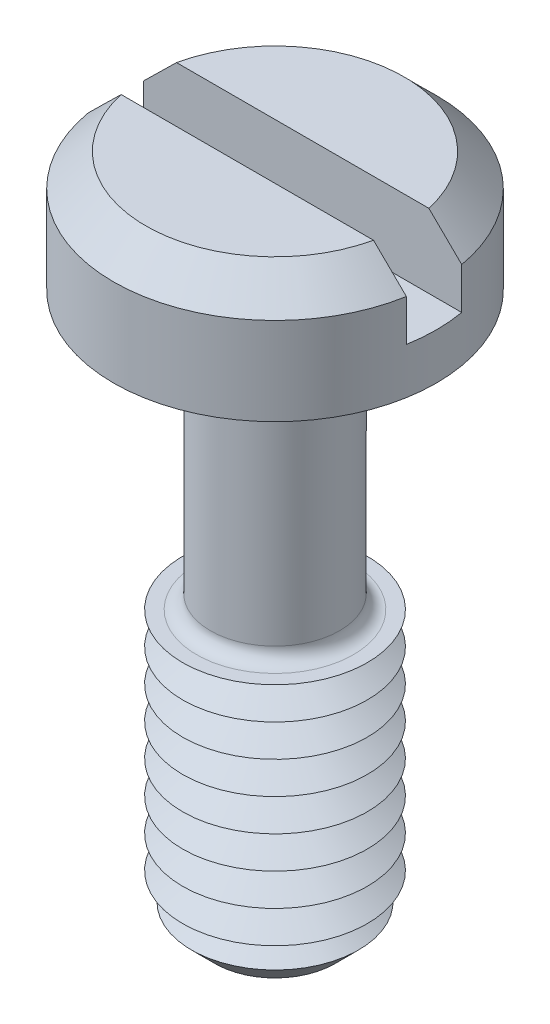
SolidWorks part; units mm, degrees
ref_plane "Front Plane" through (0, 0, 0) normal (0, 0, 1) x (1, 0, 0)
ref_plane "Top Plane" through (0, 0, 0) normal (0, 1, 0) x (1, 0, 0)
ref_plane "Right Plane" through (0, 0, 0) normal (1, 0, 0) x (0, 0, -1)
sketch "Sketch1" plane through (0, 0, 0) normal (0, 1, 0) x (1, 0, 0)
  circle A0 centre (0, 0) radius 3.5
  dimension "D1" = 7
extrude "Boss-Extrude1" add sketch "Sketch1" along normal blind 2.6
sketch "Sketch2" plane through (0, 0, 0) normal (0, -1, 0) x (1, 0, 0)
  circle A0 centre (0, 0) radius 1.4
  dimension "D1" = 2.8
extrude "Boss-Extrude2" add sketch "Sketch2" along normal blind 12
sketch "Sketch3" plane through (0, -12, 0) normal (0, -1, 0) x (1, 0, 0)
  circle A0 centre (0, 0) radius 2
  dimension "D1" = 4
extrude "Boss-Extrude3" add sketch "Sketch3" against normal blind 6
chamfer "Chamfer1" distance 0.7 angle 45 1 edges at (0, -12, -2)
sketch "Sketch4" plane through (0, 0, 0) normal (1, 0, 0) x (0, 0, -1)
  line L0 (0, -6.5871) -> (0, -12.0372) construction
sketch "Sketch5" plane through (0, 0, 0) normal (1, 0, 0) x (0, 0, -1)
  line L0 (-2, -6) -> (-1.3938, -6.35)
  line L1 (-1.3938, -6.35) -> (-2, -6.7)
  line L2 (-2, -6) -> (-2, -11.3) construction
  line L3 (-2, -6.7) -> (-2, -6)
  dimension "D1" = 0.7
revolve "Cut-Revolve1" cut sketch "Sketch5" angle 360 about L0
pattern_linear "LPattern1" count 8 spacing 0.7 along (0, -1, 0) of "Cut-Revolve1"
fillet "Fillet1" radius 0.3 2 edges at (0, -6, -1.4) (0, 0, -1.4)
chamfer "Chamfer2" distance 0.7 angle 45 1 edges at (0, 2.6, 3.5)
sketch "Sketch6" plane through (0, 2.6, 0) normal (0, 1, 0) x (1, 0, 0)
  line L1 (3.5, -0.6) -> (-3.5, -0.6)
  line L2 (3.5, -0.6) -> (3.5, 0.6)
  line L3 (3.5, 0.6) -> (-3.5, 0.6)
  line L4 (-3.5, -0.6) -> (-3.5, 0.6)
  line L5 (3.5, -0.6) -> (-3.5, 0.6) construction
  line L6 (3.5, 0.6) -> (-3.5, -0.6) construction
  circle A0 centre (0, 0) radius 3.5 construction
  point P0 (0, 0)
  dimension "D1" = 1.2
extrude "Cut-Extrude1" cut sketch "Sketch6" against normal blind 1.6
